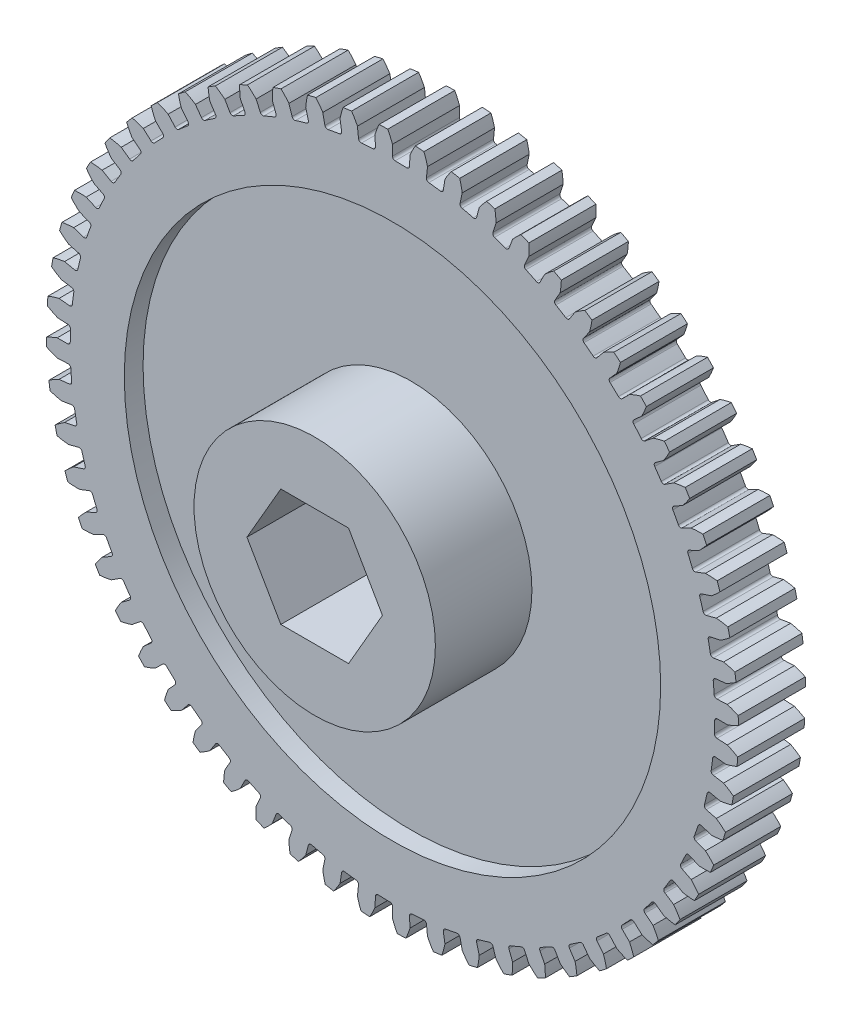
SolidWorks part; units mm, degrees
ref_plane "Front Plane" through (0, 0, 0) normal (0, 0, 1) x (1, 0, 0)
ref_plane "Top Plane" through (0, 0, 0) normal (0, 1, 0) x (1, 0, 0)
ref_plane "Right Plane" through (0, 0, 0) normal (1, 0, 0) x (0, 0, -1)
imported_body "Imported1"
sketch "Sketch1" plane through (0, 0, 6.35) normal (0, 0, 1) x (1, 0, 0)
  line L6 (279.5097, 135.5524) -> (273.0939, 135.5524)
  line L7 (273.0939, 135.5524) -> (269.886, 129.9961)
  line L8 (269.886, 129.9961) -> (273.0939, 124.4399)
  line L9 (273.0939, 124.4399) -> (279.5097, 124.4399)
  line L10 (279.5097, 124.4399) -> (282.7176, 129.9961)
  line L11 (282.7176, 129.9961) -> (279.5097, 135.5524)
  line L12 (279.5097, 135.5524) -> (273.0939, 135.5524)
  line L13 (273.0939, 135.5524) -> (269.886, 129.9961)
  line L14 (269.886, 129.9961) -> (273.0939, 124.4399)
  line L15 (273.0939, 124.4399) -> (279.5097, 124.4399)
  line L16 (279.5097, 124.4399) -> (282.7176, 129.9961)
  line L17 (282.7176, 129.9961) -> (279.5097, 135.5524)
  dimension "D1" = 0
extrude "Cut-Extrude1" cut sketch "Sketch1" against normal through all
